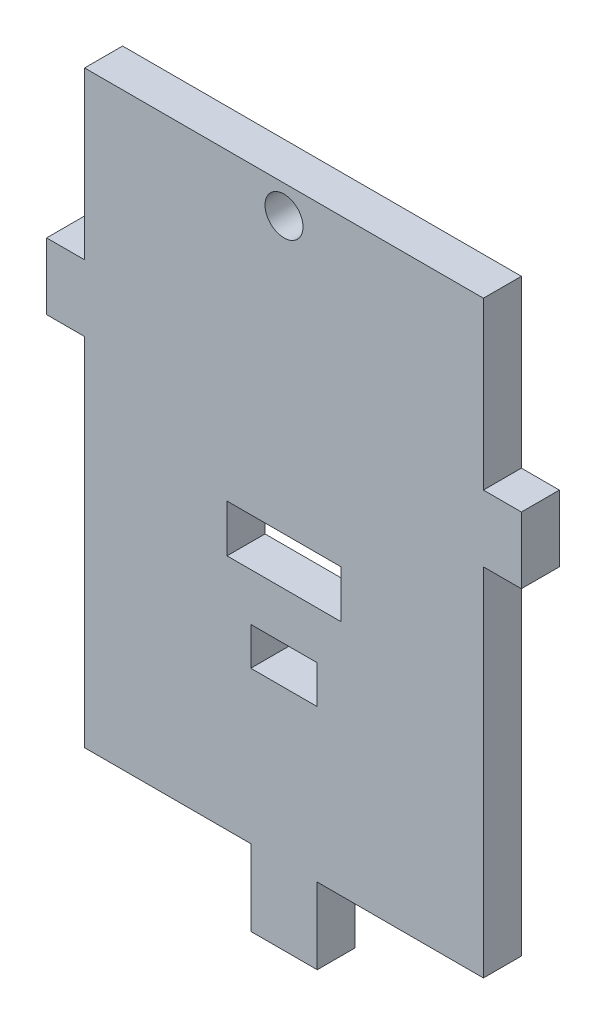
SolidWorks part; units mm, degrees
ref_plane "Front Plane" through (0, 0, 0) normal (0, 0, 1) x (1, 0, 0)
ref_plane "Top Plane" through (0, 0, 0) normal (0, 1, 0) x (1, 0, 0)
ref_plane "Right Plane" through (0, 0, 0) normal (1, 0, 0) x (0, 0, -1)
sketch "Sketch1" plane through (0, 0, 0) normal (0, 0, 1) x (1, 0, 0)
  line L0 (22.4511, -10.8647) -> (26.4511, -10.8647)
  line L1 (-19.5489, 6.6353) -> (22.4511, 6.6353)
  line L2 (-19.5489, 6.6353) -> (-19.5489, -55.3647)
  line L3 (-19.5489, -55.3647) -> (-2.0489, -55.3647)
  line L4 (22.4511, 6.6353) -> (22.4511, -55.3647)
  line L5 (-19.5489, 6.6353) -> (22.4511, -55.3647) construction
  line L6 (-19.5489, -55.3647) -> (22.4511, 6.6353) construction
  line L7 (-4.5489, -25.3647) -> (7.4511, -25.3647)
  line L8 (-2.0489, -55.3647) -> (-2.0489, -63.3647)
  line L9 (-2.0489, -63.3647) -> (4.9511, -63.3647)
  line L10 (4.9511, -55.3647) -> (4.9511, -63.3647)
  line L11 (-4.5489, -25.3647) -> (-4.5489, -30.3647)
  line L12 (-4.5489, -30.3647) -> (7.4511, -30.3647)
  line L13 (-2.0489, -35.3647) -> (4.9511, -35.3647)
  line L14 (-2.0489, -35.3647) -> (-2.0489, -39.3647)
  line L15 (-2.0489, -39.3647) -> (4.9511, -39.3647)
  line L16 (4.9511, -35.3647) -> (4.9511, -39.3647)
  line L17 (7.4511, -25.3647) -> (7.4511, -30.3647)
  line L19 (-23.5489, -10.8647) -> (-19.5489, -10.8647)
  line L20 (-23.5489, -10.8647) -> (-23.5489, -17.8647)
  line L21 (-23.5489, -17.8647) -> (-19.5489, -17.8647)
  line L22 (-19.5489, -10.8647) -> (-19.5489, -17.8647)
  line L25 (22.4511, -10.8647) -> (22.4511, -17.8647)
  line L26 (22.4511, -17.8647) -> (26.4511, -17.8647)
  line L27 (26.4511, -10.8647) -> (26.4511, -17.8647)
  line L30 (4.9511, -55.3647) -> (22.4511, -55.3647)
  circle A0 centre (1.4511, 3.6353) radius 2
  point P0 (1.4511, -24.3647)
  point P5 (1.4511, -59.3647)
  point P10 (1.4511, -63.3647)
  point P11 (1.4511, 6.6353)
  point P12 (-4.0489, -37.3647)
  point P19 (-27.0489, -14.3457)
  point P26 (18.9511, -14.3457)
  point P32 (1.4511, -35.3647)
  point P33 (1.4511, -30.3647)
  dimension "D3" = 3
  dimension "D1" = 42
  dimension "D2" = 62
  dimension "D4" = 17.5
  dimension "D5" = 21.5
extrude "Boss-Extrude1" add sketch "Sketch1" along normal blind 4 contours L10 L30 L4 L1 L2 L3 L8 L9 A0 L13 L16 L15 L14 | L20 L21 L22 L19 | L27 L26 L25 L0
